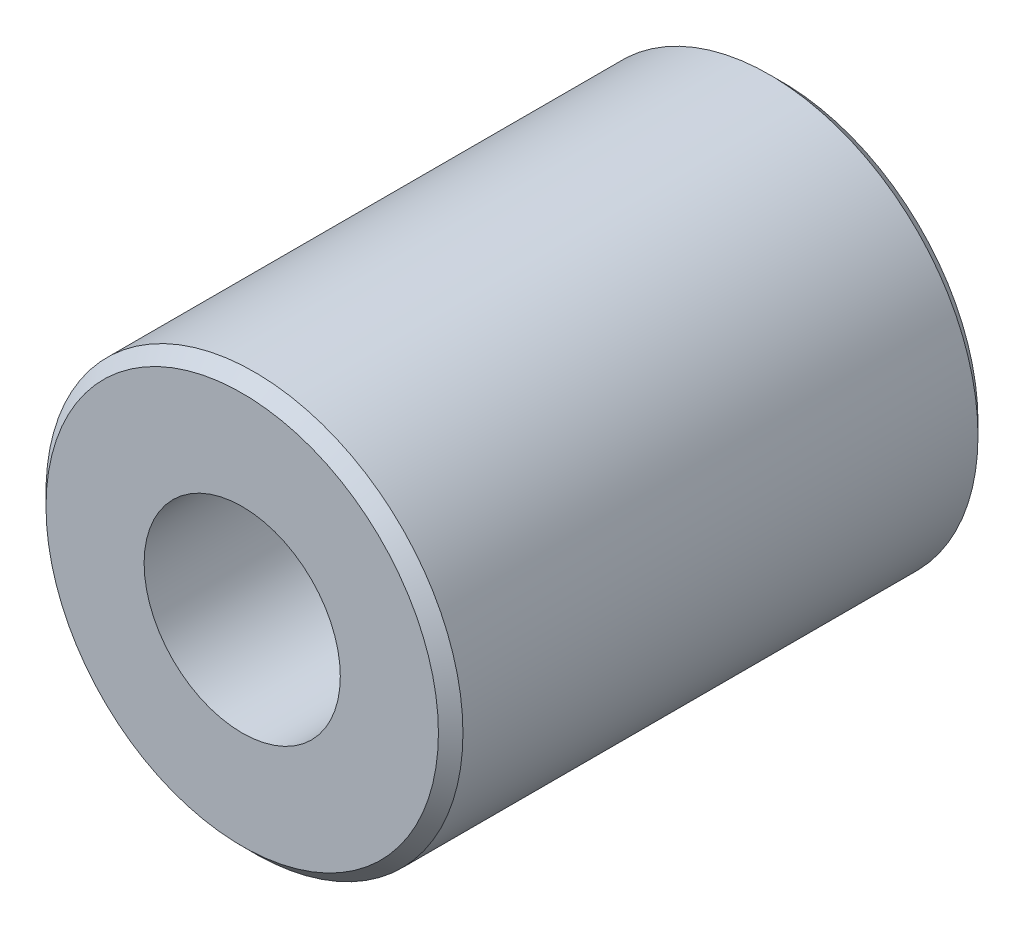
SolidWorks part; units mm, degrees
ref_plane "Face" through (0, 0, 0) normal (0, 0, 1) x (1, 0, 0)
ref_plane "Dessus" through (0, 0, 0) normal (0, 1, 0) x (1, 0, 0)
ref_plane "Droite" through (0, 0, 0) normal (1, 0, 0) x (0, 0, -1)
sketch "Esquisse1" plane through (0, 0, 0) normal (0, 0, 1) x (1, 0, 0)
  circle A0 centre (0, 0) radius 2
  circle A1 centre (0, 0) radius 4.25
  dimension "D1" = 8.5
  dimension "D2" = 4
extrude "Extrusion1" add sketch "Esquisse1" along normal blind 11
chamfer "Chanfrein1" distance 0.25 angle 45 2 edges at (4.25, 0, 0) (4.25, 0, 11)
